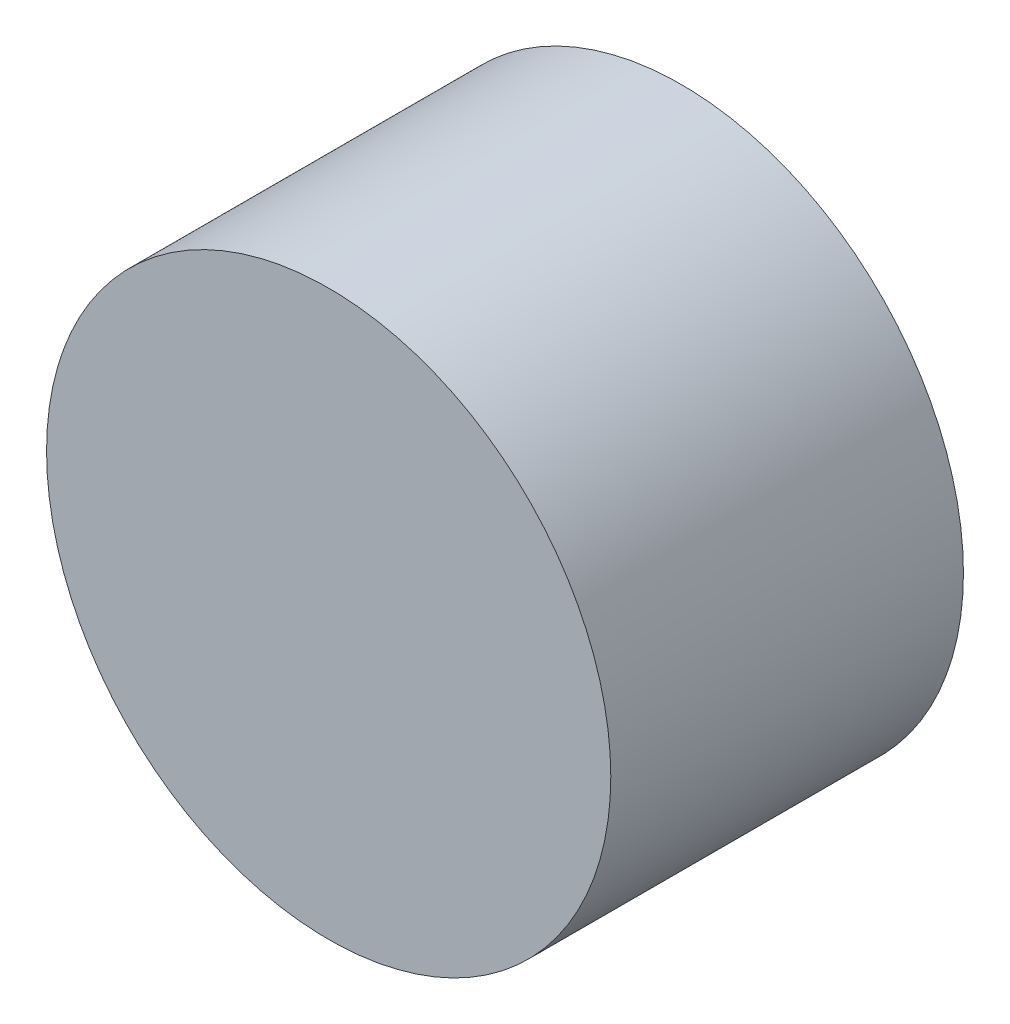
SolidWorks part; units mm, degrees
ref_plane "Front Plane" through (0, 0, 0) normal (0, 0, 1) x (1, 0, 0)
ref_plane "Top Plane" through (0, 0, 0) normal (0, 1, 0) x (1, 0, 0)
ref_plane "Right Plane" through (0, 0, 0) normal (1, 0, 0) x (0, 0, -1)
sketch "Sketch1" plane through (0, 0, 0) normal (0, 0, 1) x (1, 0, 0)
  line L0 (0, 15) -> (0, 0) construction
  circle A0 centre (0, 0) radius 20
  circle A1 centre (0, 15) radius 2.5
  circle A2 centre (10.6066, 10.6066) radius 2.5
  circle A3 centre (15, 0) radius 2.5
  circle A4 centre (10.6066, -10.6066) radius 2.5
  circle A5 centre (0, -15) radius 2.5
  circle A6 centre (-10.6066, -10.6066) radius 2.5
  circle A7 centre (-15, 0) radius 2.5
  circle A8 centre (-10.6066, 10.6066) radius 2.5
  circle A9 centre (0, 5) radius 2.5
  circle A10 centre (5, 0) radius 2.5
  circle A11 centre (0, -5) radius 2.5
  circle A12 centre (-5, 0) radius 2.5
  point P21 (0, 0)
  point P31 (0, 0)
  dimension "D1" = 40
  dimension "D3" = 5
  dimension "D4" = 8
  dimension "D5" = 5
  dimension "D2" = 15
  dimension "D6" = 5
  dimension "D7" = 4
extrude "Boss-Extrude1" add sketch "Sketch1" along normal blind 10
sketch "Sketch2" plane through (0, 0, 10) normal (0, 0, 1) x (1, 0, 0)
  circle A0 centre (0, 0) radius 20
extrude "Boss-Extrude2" add sketch "Sketch2" along normal blind 15
